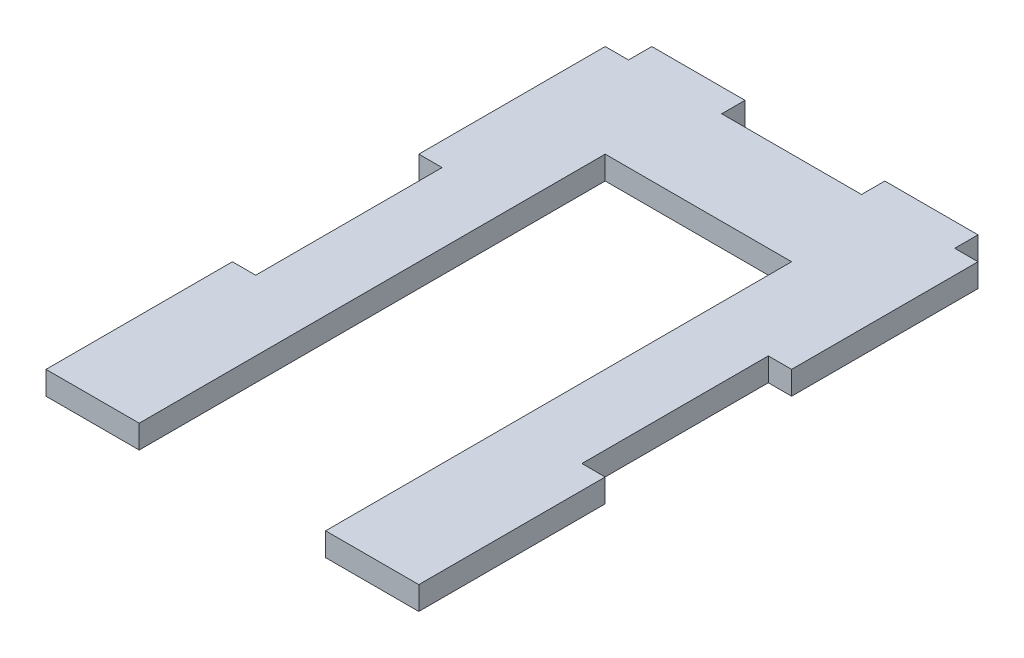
SolidWorks part; units mm, degrees
ref_plane "Front Plane" through (0, 0, 0) normal (0, 0, 1) x (1, 0, 0)
ref_plane "Top Plane" through (0, 0, 0) normal (0, 1, 0) x (1, 0, 0)
ref_plane "Right Plane" through (0, 0, 0) normal (1, 0, 0) x (0, 0, -1)
sketch "Sketch1" plane through (0, 0, 0) normal (0, 1, 0) x (1, 0, 0)
  line L0 (-25.4, -3.175) -> (-25.4, -28.575)
  line L1 (-9.525, -3.175) -> (9.525, -3.175)
  line L2 (0, -39.6875) -> (-12.7, -39.6875) construction
  line L3 (-22.225, 0) -> (-9.525, 0)
  line L4 (25.4, -3.175) -> (25.4, -28.575)
  line L5 (0, -39.6875) -> (12.7, -39.6875) construction
  line L6 (0, -3.175) -> (0, -15.875) construction
  line L7 (22.225, 0) -> (9.525, 0)
  line L8 (22.225, -3.175) -> (25.4, -3.175)
  line L9 (-25.4, -3.175) -> (-22.225, -3.175)
  line L10 (12.7, -79.375) -> (22.225, -79.375)
  line L11 (25.4, -28.575) -> (22.225, -28.575)
  line L12 (25.4, -79.375) -> (22.225, -79.375)
  line L13 (22.225, 0) -> (22.225, -3.175)
  line L14 (-25.4, -28.575) -> (-22.225, -28.575)
  line L15 (-25.4, -79.375) -> (-22.225, -79.375)
  line L16 (-22.225, 0) -> (-22.225, -3.175)
  line L18 (-25.4, -79.375) -> (-25.4, -53.975)
  line L19 (25.4, -79.375) -> (25.4, -53.975)
  line L21 (25.4, -53.975) -> (22.225, -53.975)
  line L22 (-25.4, -53.975) -> (-22.225, -53.975)
  line L23 (-9.525, 0) -> (-9.525, -3.175)
  line L24 (9.525, 0) -> (9.525, -3.175)
  line L25 (-22.225, -79.375) -> (-12.7, -79.375)
  line L26 (-22.225, -28.575) -> (-22.225, -53.975)
  line L27 (22.225, -28.575) -> (22.225, -53.975)
  line L28 (-12.7, -79.375) -> (-12.7, -15.875)
  line L29 (-12.7, -15.875) -> (12.7, -15.875)
  line L30 (12.7, -79.375) -> (12.7, -15.875)
  point P0 (0, -39.6875)
extrude "Boss-Extrude1" add sketch "Sketch1" along normal blind 3.175
